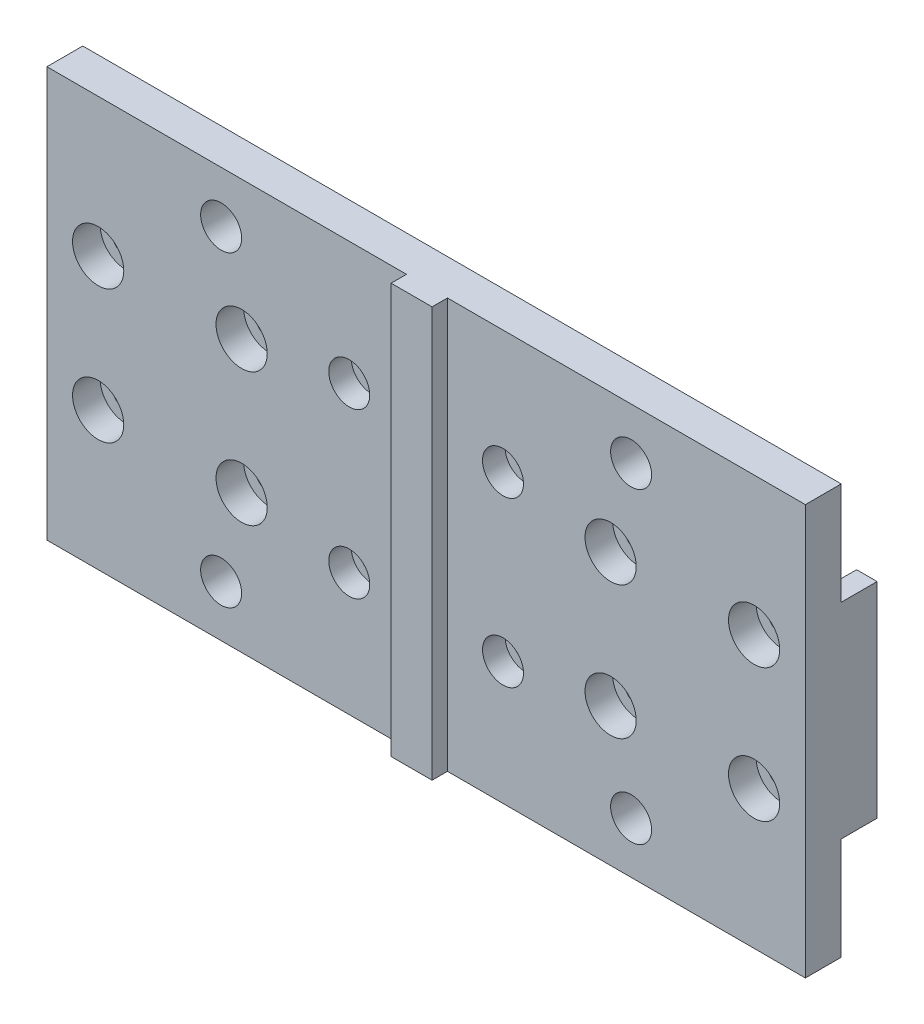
SolidWorks part; units mm, degrees
ref_plane "Plan de face" through (0, 0, 0) normal (0, 0, 1) x (1, 0, 0)
ref_plane "Plan de dessus" through (0, 0, 0) normal (0, 1, 0) x (1, 0, 0)
ref_plane "Plan de droite" through (0, 0, 0) normal (1, 0, 0) x (0, 0, -1)
sketch "Esquisse1" plane through (0, 0, 0) normal (0, 0, 1) x (1, 0, 0)
  line L0 (0, 80.3793) -> (0, -91.4076) construction
  line L1 (-74, 26.3924) -> (74, 26.3924)
  line L2 (-74, 26.3924) -> (-74, -53.6076)
  line L3 (-74, -53.6076) -> (74, -53.6076)
  line L4 (74, 26.3924) -> (74, -53.6076)
  line L5 (-70, 26.3924) -> (-70, -53.6076) construction
  line L6 (70, 26.3924) -> (70, -53.6076) construction
  line L7 (-30, 26.3924) -> (-30, -53.6076) construction
  line L8 (30, 26.3924) -> (30, -53.6076) construction
  line L9 (20, 26.3924) -> (20, -53.6076) construction
  line L10 (-20, 26.3924) -> (-20, -53.6076) construction
  line L11 (-64, -0.6076) -> (-64, -26.6076) construction
  line L12 (-36, -0.6076) -> (-36, -26.6076) construction
  line L13 (36, -0.6076) -> (36, -26.6076) construction
  line L14 (64, -0.6076) -> (64, -26.6076) construction
  line L15 (-46, 26.3924) -> (-46, -53.6076) construction
  line L16 (-14, 26.3924) -> (-14, -53.6076) construction
  line L17 (-46, -13.6076) -> (-87.0016, -13.6076) construction
  line L18 (46, 26.3924) -> (46, -53.6076) construction
  line L19 (14, 26.3924) -> (14, -53.6076) construction
  line L20 (46, -13.6076) -> (86.0513, -13.6076) construction
  line L21 (15, -53.6076) -> (15, 26.3924) construction
  line L22 (-15, -53.6076) -> (-15, 26.3924) construction
  circle A0 centre (-64, -0.6076) radius 2.5
  circle A1 centre (-36, -0.6076) radius 2.5
  circle A2 centre (-64, -26.6076) radius 2.5
  circle A3 centre (-36, -26.6076) radius 2.5
  circle A4 centre (36, -0.6076) radius 2.5
  circle A5 centre (64, -0.6076) radius 2.5
  circle A6 centre (36, -26.6076) radius 2.5
  circle A7 centre (64, -26.6076) radius 2.5
  circle A10 centre (15, 2.3924) radius 2
  circle A11 centre (15, -29.6076) radius 2
  circle A12 centre (-15, 2.3924) radius 2
  circle A13 centre (-15, -29.6076) radius 2
  dimension "D9" = 5
  dimension "D10" = 5
  dimension "D11" = 5
  dimension "D12" = 5
  dimension "D13" = 5
  dimension "D14" = 5
  dimension "D15" = 5
  dimension "D16" = 5
  dimension "D26" = 32
  dimension "D31" = 5
  dimension "D32" = 5
  dimension "D33" = 4
  dimension "D34" = 4
  dimension "D41" = 4
  dimension "D42" = 4
  dimension "D44" = 24
  dimension "D46" = 24
  dimension "D1" = 148
  dimension "D2" = 80
  dimension "D4" = 20
  dimension "D5" = 40
  dimension "D6" = 40
  dimension "D7" = 10
  dimension "D8" = 10
  dimension "D17" = 26
  dimension "D18" = 28
  dimension "D19" = 6
  dimension "D20" = 27
  dimension "D21" = 28
  dimension "D22" = 26
  dimension "D23" = 6
  dimension "D24" = 27
  dimension "D25" = 28
  dimension "D28" = 28
  dimension "D29" = 32
  dimension "D35" = 27
  dimension "D36" = 27
  dimension "D37" = 27
  dimension "D38" = 20
  dimension "D39" = 26
  dimension "D40" = 74
  dimension "D43" = 24
  dimension "D45" = 24
extrude "Extrusion1" add sketch "Esquisse1" along normal blind 4
sketch "Esquisse2" plane through (0, 0, 4) normal (0, 0, 1) x (1, 0, 0)
  line L0 (-74, 16.3924) -> (74, 16.3924) construction
  line L1 (-74, 26.3924) -> (-74, -53.6076) construction
  line L2 (74, -53.6076) -> (74, 26.3924) construction
  line L3 (-74, -43.6076) -> (74, -43.6076) construction
  line L4 (74, 26.3924) -> (-74, 26.3924) construction
  line L5 (-74, -53.6076) -> (74, -53.6076) construction
  line L6 (0, 26.3924) -> (0, -53.6076) construction
  circle A0 centre (-40, 16.3924) radius 4
  circle A1 centre (-40, -43.6076) radius 4
  circle A2 centre (40, 16.3924) radius 4
  circle A3 centre (40, -43.6076) radius 4
  dimension "D3" = 8
  dimension "D5" = 80
  dimension "D6" = 40
  dimension "D7" = 40
  dimension "D1" = 10
  dimension "D2" = 10
  dimension "D4" = 80
extrude "Enlèv. mat.-Extru.1" cut sketch "Esquisse2" against normal through all
sketch "Esquisse3" plane through (0, 0, 4) normal (0, 0, 1) x (1, 0, 0)
  line L1 (-74, 26.3924) -> (74, 26.3924)
  line L2 (-74, 26.3924) -> (-74, -53.6076)
  line L3 (-74, -53.6076) -> (74, -53.6076)
  line L4 (74, 26.3924) -> (74, -53.6076)
extrude "Boss.-Extru.1" add sketch "Esquisse3" along normal blind 3
hole_wizard "Chambrage pour vis à tête hexagonale M41" positions "Esquisse5" profile "Esquisse4" counterbore size "M4" standard "ISO"
sketch "Esquisse5" plane through (0, 0, 7) normal (0, 0, 1) x (1, 0, 0)
  line L0 (0, 26.3924) -> (0, -53.6076) construction
  line L1 (74, 26.3924) -> (-74, 26.3924) construction
  line L2 (-74, -53.6076) -> (74, -53.6076) construction
  point P0 (-15, 2.3924)
  point P2 (15, 2.3924)
  point P4 (15, -29.6076)
  point P6 (-15, -29.6076)
  dimension "D1" = 15
  dimension "D2" = 15
  dimension "D3" = 15
  dimension "D4" = 15
  dimension "D5" = 24
  dimension "D6" = 24
  dimension "D7" = 24
  dimension "D8" = 24
sketch "Esquisse4" plane through (-15, 2.3924, 7) normal (1, 0, 0) x (0, -1, 0)
  line L0 (0, 0) -> (0, 7)
  line L1 (0, 7) -> (2.25, 7)
  line L3 (2.25, 7) -> (2.25, 4.4)
  line L4 (2.25, 4.4) -> (4, 4.4)
  line L5 (4, 4.4) -> (4, 0)
  line L7 (4, 0) -> (0, 0)
  line L11 (0, -6.35) -> (0, 107.95) construction
  dimension "Diamètre du perçage jusqu'au prochain" = 4.5
  dimension "Profondeur du perçage jusqu'au prochain" = 7
  dimension "Diamètre du chambrage" = 8
  dimension "Profondeur du chambrage" = 4.4
hole_wizard "Chambrage pour vis à tête hexagonale M51" positions "Esquisse7" profile "Esquisse6" counterbore size "M5" standard "ISO"
sketch "Esquisse7" plane through (0, 0, 7) normal (0, 0, 1) x (1, 0, 0)
  line L0 (-74, -13.6076) -> (74, -13.6076) construction
  line L1 (-74, 26.3924) -> (-74, -53.6076) construction
  line L2 (74, -53.6076) -> (74, 26.3924) construction
  line L11 (0, 26.3924) -> (0, -53.6076) construction
  line L12 (74, 26.3924) -> (-74, 26.3924) construction
  line L13 (-74, -53.6076) -> (74, -53.6076) construction
  line L16 (-30, 26.3924) -> (-30, -53.6076) construction
  line L19 (30, 26.3924) -> (30, -53.6076) construction
  point P0 (-64, -0.6076)
  point P2 (-36, -0.6076)
  point P4 (-36, -26.6076)
  point P6 (-64, -26.6076)
  point P8 (36, -0.6076)
  point P10 (64, -0.6076)
  point P12 (64, -26.6076)
  point P14 (36, -26.6076)
  dimension "D1" = 30
  dimension "D2" = 30
  dimension "D3" = 13
  dimension "D4" = 13
  dimension "D5" = 26
  dimension "D6" = 26
  dimension "D7" = 13
  dimension "D8" = 26
  dimension "D9" = 13
  dimension "D10" = 26
  dimension "D11" = 6
  dimension "D12" = 6
  dimension "D13" = 28
  dimension "D14" = 28
  dimension "D15" = 6
  dimension "D16" = 6
  dimension "D17" = 28
  dimension "D18" = 28
sketch "Esquisse6" plane through (-64, -0.6076, 7) normal (1, 0, 0) x (0, -1, 0)
  line L0 (0, 0) -> (0, 7)
  line L1 (0, 7) -> (2.75, 7)
  line L3 (2.75, 7) -> (2.75, 5.4)
  line L4 (2.75, 5.4) -> (5, 5.4)
  line L5 (5, 5.4) -> (5, 0)
  line L7 (5, 0) -> (0, 0)
  line L11 (0, -6.35) -> (0, 107.95) construction
  dimension "Diamètre du perçage jusqu'au prochain" = 5.5
  dimension "Profondeur du perçage jusqu'au prochain" = 7
  dimension "Diamètre du chambrage" = 10
  dimension "Profondeur du chambrage" = 5.4
sketch "Esquisse8" plane through (0, 0, 0) normal (0, 0, -1) x (-1, 0, 0)
  circle A0 centre (40, -43.6076) radius 4
  circle A1 centre (40, 16.3924) radius 4
  circle A2 centre (-40, 16.3924) radius 4
  circle A3 centre (-40, -43.6076) radius 4
extrude "Enlèv. mat.-Extru.2" cut sketch "Esquisse8" against normal through all
sketch "Esquisse9" plane through (0, 0, 0) normal (0, 0, -1) x (-1, 0, 0)
  line L0 (-74, -13.6076) -> (74, -13.6076) construction
  line L1 (-74, -53.6076) -> (-74, 26.3924) construction
  line L2 (74, 26.3924) -> (74, -53.6076) construction
  line L4 (-74, 6.3924) -> (74, 6.3924)
  line L5 (-74, 6.3924) -> (-74, -33.6076)
  line L6 (-74, -33.6076) -> (74, -33.6076)
  line L7 (74, 6.3924) -> (74, -33.6076)
  circle A0 centre (-64, -0.6076) radius 2.75
  circle A1 centre (-64, -26.6076) radius 2.75
  circle A2 centre (-36, -0.6076) radius 2.75
  circle A3 centre (-36, -26.6076) radius 2.75
  circle A4 centre (-15, 2.3924) radius 2.25
  circle A5 centre (15, 2.3924) radius 2.25
  circle A6 centre (-15, -29.6076) radius 2.25
  circle A7 centre (15, -29.6076) radius 2.25
  circle A8 centre (36, -0.6076) radius 2.75
  circle A9 centre (64, -0.6076) radius 2.75
  circle A10 centre (36, -26.6076) radius 2.75
  circle A11 centre (64, -26.6076) radius 2.75
  dimension "D1" = 40
  dimension "D2" = 20
extrude "Boss.-Extru.2" add sketch "Esquisse9" along normal blind 4
sketch "Esquisse10" plane through (0, 0, -4) normal (0, 0, -1) x (-1, 0, 0)
  line L0 (-74, -33.6076) -> (74, -33.6076) construction
  line L1 (-74, 6.3924) -> (-70, 6.3924)
  line L2 (-74, 6.3924) -> (-74, -33.6076)
  line L3 (-74, -33.6076) -> (-70, -33.6076)
  line L4 (-70, 6.3924) -> (-70, -33.6076)
  line L5 (74, 6.3924) -> (-74, 6.3924) construction
  line L6 (-30, 6.3924) -> (-20, 6.3924)
  line L7 (-30, 6.3924) -> (-30, -33.6076)
  line L8 (-30, -33.6076) -> (-20, -33.6076)
  line L9 (-20, 6.3924) -> (-20, -33.6076)
  line L10 (74, -33.6076) -> (74, 6.3924) construction
  line L11 (20, 6.3924) -> (30, 6.3924)
  line L12 (20, 6.3924) -> (20, -33.6076)
  line L13 (20, -33.6076) -> (30, -33.6076)
  line L14 (30, 6.3924) -> (30, -33.6076)
  line L15 (70, 6.3924) -> (74, 6.3924)
  line L16 (70, 6.3924) -> (70, -33.6076)
  line L17 (70, -33.6076) -> (74, -33.6076)
  line L18 (74, 6.3924) -> (74, -33.6076)
  line L19 (-74, -33.6076) -> (74, -33.6076) construction
  dimension "D1" = 4
  dimension "D2" = 4
  dimension "D3" = 40
  dimension "D4" = 40
  dimension "D5" = 10
  dimension "D6" = 10
extrude "Boss.-Extru.3" add sketch "Esquisse10" along normal blind 3
sketch "Esquisse11" plane through (0, 0, 7) normal (0, 0, 1) x (1, 0, 0)
  line L0 (74, 26.3924) -> (-74, 26.3924) construction
  line L1 (-3.8364, 26.3924) -> (4.1636, 26.3924)
  line L2 (-3.8364, 26.3924) -> (-3.8364, -53.6076)
  line L3 (-3.8364, -53.6076) -> (4.1636, -53.6076)
  line L4 (4.1636, 26.3924) -> (4.1636, -53.6076)
  line L5 (-74, -53.6076) -> (74, -53.6076) construction
  line L6 (0.1636, 38.0166) -> (0.1636, -65.5655) construction
  dimension "D1" = 4
  dimension "D2" = 8
extrude "Boss.-Extru.4" add sketch "Esquisse11" along normal blind 3
